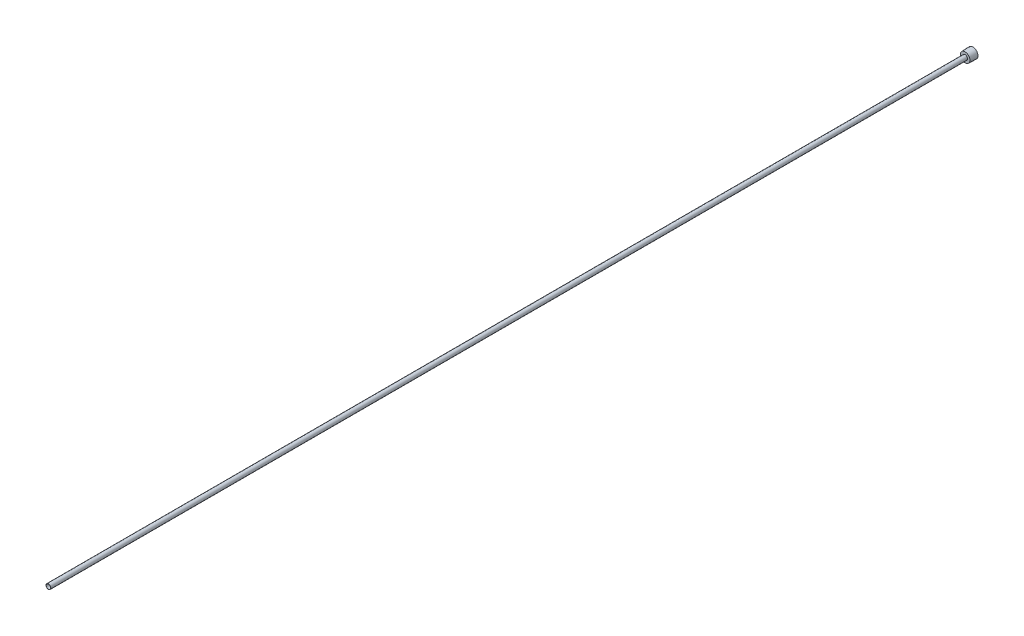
SolidWorks part; units mm, degrees
ref_plane "Front Plane" through (0, 0, 0) normal (0, 0, 1) x (1, 0, 0)
ref_plane "Top Plane" through (0, 0, 0) normal (0, 1, 0) x (1, 0, 0)
ref_plane "Right Plane" through (0, 0, 0) normal (1, 0, 0) x (0, 0, -1)
sketch "Sketch1" plane through (0, 0, 0) normal (1, 0, 0) x (0, 0, -1)
  line L0 (-331.1242, 0) -> (49668.8758, 0) construction
  line L1 (0, 0) -> (-1219.2, 0)
  line L6 (0, 0) -> (0, 6.7183)
  line L7 (0, 6.7183) -> (-10.3124, 6.3421)
  line L8 (-10.3124, 3.175) -> (-1219.2, 3.175)
  line L9 (-10.3124, 6.3421) -> (-10.3124, 3.175)
  line L10 (-1219.2, 3.175) -> (-1219.2, 0)
  dimension "D1" = 6.35
  dimension "D2" = 10.3124
  dimension "D3" = 2.089
  dimension "D4" = 13.4366
  dimension "D5" = 1219.2
revolve "Revolve1" add sketch "Sketch1" angle 360 about L0
sketch "Sketch2" plane through (0, 0, 1219.2) normal (0, 0, 1) x (1, 0, 0)
  circle A0 centre (0, 0) radius 2.921
  dimension "D1" = 5.842
extrude "Cut-Extrude1" cut sketch "Sketch2" against normal through all
sketch "Sketch3" plane through (0, 0, 0) normal (0, 0, -1) x (-1, 0, 0)
  line L0 (0, 7.3901) -> (0, -7.3901) construction
  line L1 (-3.175, -1.8331) -> (0, -3.6662)
  line L2 (0, -3.6662) -> (3.175, -1.8331)
  line L3 (3.175, -1.8331) -> (3.175, 1.8331)
  line L4 (3.175, 1.8331) -> (0, 3.6662)
  line L5 (0, 3.6662) -> (-3.175, 1.8331)
  line L6 (-3.175, 1.8331) -> (-3.175, -1.8331)
  circle A0 centre (0, 0) radius 3.175 construction
  dimension "D1" = 6.35
extrude "Cut-Extrude2" cut sketch "Sketch3" against normal blind 6.35
